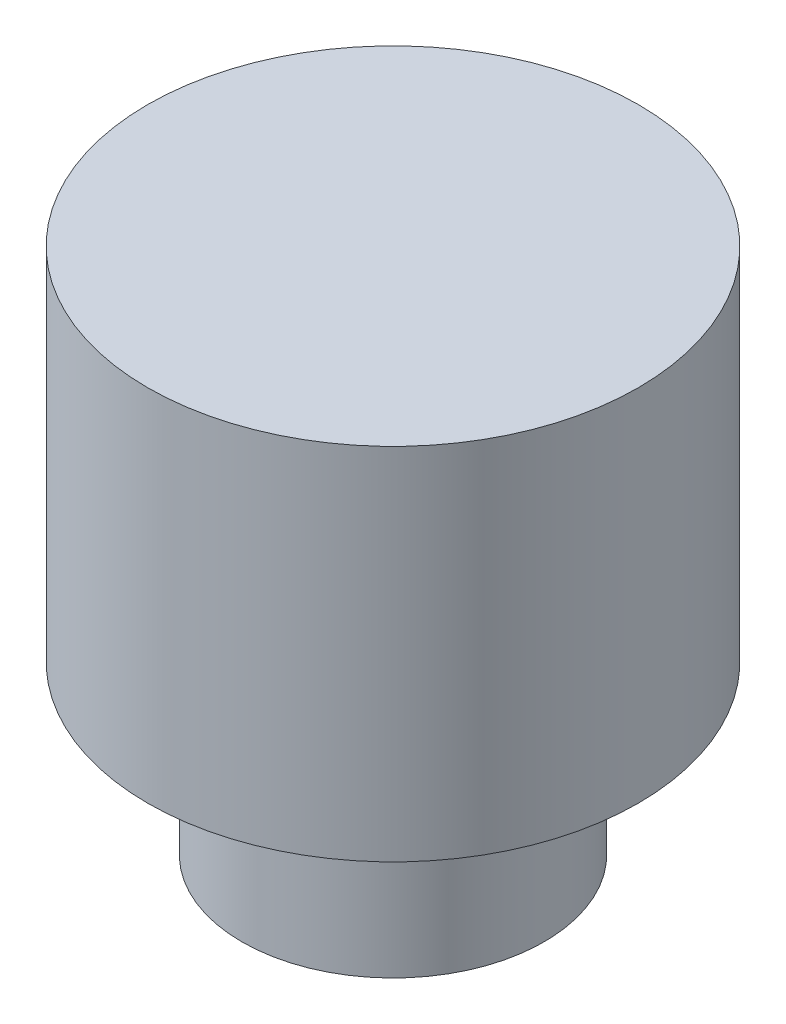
SolidWorks part; units mm, degrees
ref_plane "Plan de face" through (0, 0, 0) normal (0, 0, 1) x (1, 0, 0)
ref_plane "Plan de dessus" through (0, 0, 0) normal (0, 1, 0) x (1, 0, 0)
ref_plane "Plan de droite" through (0, 0, 0) normal (1, 0, 0) x (0, 0, -1)
sketch "Esquisse1" plane through (0, 0, 0) normal (0, 1, 0) x (1, 0, 0)
  circle A0 centre (0, 0) radius 10.5
  dimension "D1" = 21
extrude "Extrusion1" add sketch "Esquisse1" along normal blind 11.61
sketch "Esquisse3" plane through (0, 11.61, 0) normal (0, 1, 0) x (1, 0, 0)
  circle A0 centre (0, 0) radius 17.04
  dimension "D1" = 34.08
extrude "Extrusion2" add sketch "Esquisse3" along normal blind 25
